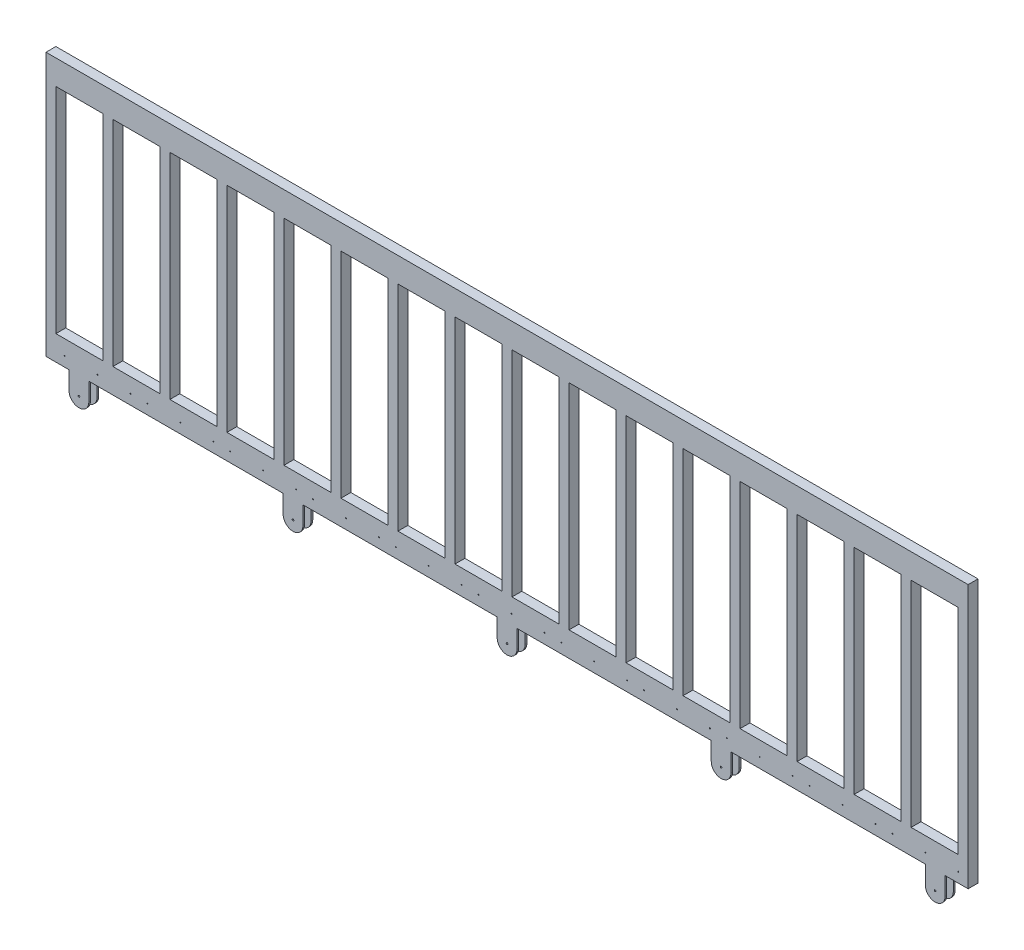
SolidWorks part; units mm, degrees
ref_plane "Plan de face" through (0, 0, 0) normal (0, 0, 1) x (1, 0, 0)
ref_plane "Plan de dessus" through (0, 0, 0) normal (0, 1, 0) x (1, 0, 0)
ref_plane "Plan de droite" through (0, 0, 0) normal (1, 0, 0) x (0, 0, -1)
sketch "Esquisse1" plane through (0, 0, 0) normal (0, 0, 1) x (1, 0, 0)
  line L1 (0, 0) -> (5600, 0)
  line L2 (0, 0) -> (0, 1600)
  line L3 (0, 1600) -> (5600, 1600)
  line L4 (5600, 0) -> (5600, 1600)
  dimension "D1" = 5600
  dimension "D2" = 1600
extrude "Boss.-Extru.1" add sketch "Esquisse1" against normal mid plane 60
sketch "Esquisse2" plane through (0, 0, 30) normal (0, 0, 1) x (1, 0, 0)
  line L0 (0, 800) -> (3591.6944, 800) construction
  line L1 (0, 1600) -> (0, 0) construction
  line L2 (5600, 1600) -> (0, 1600) construction
  line L3 (60, 150) -> (346.25, 150)
  line L4 (60, 150) -> (60, 1450)
  line L5 (60, 1450) -> (346.25, 1450)
  line L6 (346.25, 150) -> (346.25, 1450)
  line L7 (60, 150) -> (346.25, 1450) construction
  line L8 (60, 1450) -> (346.25, 150) construction
  line L9 (406.25, 150) -> (692.5, 150)
  line L10 (406.25, 150) -> (406.25, 1450)
  line L11 (406.25, 1450) -> (692.5, 1450)
  line L12 (692.5, 150) -> (692.5, 1450)
  line L13 (406.25, 150) -> (692.5, 1450) construction
  line L14 (406.25, 1450) -> (692.5, 150) construction
  line L15 (752.5, 150) -> (1038.75, 150)
  line L16 (752.5, 150) -> (752.5, 1450)
  line L17 (752.5, 1450) -> (1038.75, 1450)
  line L18 (1038.75, 150) -> (1038.75, 1450)
  line L19 (752.5, 150) -> (1038.75, 1450) construction
  line L20 (752.5, 1450) -> (1038.75, 150) construction
  line L21 (1098.75, 150) -> (1385, 150)
  line L22 (1098.75, 150) -> (1098.75, 1450)
  line L23 (1098.75, 1450) -> (1385, 1450)
  line L24 (1385, 150) -> (1385, 1450)
  line L25 (1098.75, 150) -> (1385, 1450) construction
  line L26 (1098.75, 1450) -> (1385, 150) construction
  line L27 (1445, 150) -> (1731.25, 150)
  line L28 (1445, 150) -> (1445, 1450)
  line L29 (1445, 1450) -> (1731.25, 1450)
  line L30 (1731.25, 150) -> (1731.25, 1450)
  line L31 (1445, 150) -> (1731.25, 1450) construction
  line L32 (1445, 1450) -> (1731.25, 150) construction
  line L33 (1791.25, 150) -> (2077.5, 150)
  line L34 (1791.25, 150) -> (1791.25, 1450)
  line L35 (1791.25, 1450) -> (2077.5, 1450)
  line L36 (2077.5, 150) -> (2077.5, 1450)
  line L37 (1791.25, 150) -> (2077.5, 1450) construction
  line L38 (1791.25, 1450) -> (2077.5, 150) construction
  line L39 (2137.5, 150) -> (2423.75, 150)
  line L40 (2137.5, 150) -> (2137.5, 1450)
  line L41 (2137.5, 1450) -> (2423.75, 1450)
  line L42 (2423.75, 150) -> (2423.75, 1450)
  line L43 (2137.5, 150) -> (2423.75, 1450) construction
  line L44 (2137.5, 1450) -> (2423.75, 150) construction
  line L45 (2483.75, 150) -> (2770, 150)
  line L46 (2483.75, 150) -> (2483.75, 1450)
  line L47 (2483.75, 1450) -> (2770, 1450)
  line L48 (2770, 150) -> (2770, 1450)
  line L49 (2483.75, 150) -> (2770, 1450) construction
  line L50 (2483.75, 1450) -> (2770, 150) construction
  line L51 (2830, 150) -> (3116.25, 150)
  line L52 (2830, 150) -> (2830, 1450)
  line L53 (2830, 1450) -> (3116.25, 1450)
  line L54 (3116.25, 150) -> (3116.25, 1450)
  line L55 (2830, 150) -> (3116.25, 1450) construction
  line L56 (2830, 1450) -> (3116.25, 150) construction
  line L57 (3176.25, 150) -> (3462.5, 150)
  line L58 (3176.25, 150) -> (3176.25, 1450)
  line L59 (3176.25, 1450) -> (3462.5, 1450)
  line L60 (3462.5, 150) -> (3462.5, 1450)
  line L61 (3176.25, 150) -> (3462.5, 1450) construction
  line L62 (3176.25, 1450) -> (3462.5, 150) construction
  line L63 (3522.5, 150) -> (3808.75, 150)
  line L64 (3522.5, 150) -> (3522.5, 1450)
  line L65 (3522.5, 1450) -> (3808.75, 1450)
  line L66 (3808.75, 150) -> (3808.75, 1450)
  line L67 (3522.5, 150) -> (3808.75, 1450) construction
  line L68 (3522.5, 1450) -> (3808.75, 150) construction
  line L69 (3868.75, 150) -> (4155, 150)
  line L70 (3868.75, 150) -> (3868.75, 1450)
  line L71 (3868.75, 1450) -> (4155, 1450)
  line L72 (4155, 150) -> (4155, 1450)
  line L73 (3868.75, 150) -> (4155, 1450) construction
  line L74 (3868.75, 1450) -> (4155, 150) construction
  line L75 (4215, 150) -> (4501.25, 150)
  line L76 (4215, 150) -> (4215, 1450)
  line L77 (4215, 1450) -> (4501.25, 1450)
  line L78 (4501.25, 150) -> (4501.25, 1450)
  line L79 (4215, 150) -> (4501.25, 1450) construction
  line L80 (4215, 1450) -> (4501.25, 150) construction
  line L81 (4561.25, 150) -> (4847.5, 150)
  line L82 (4561.25, 150) -> (4561.25, 1450)
  line L83 (4561.25, 1450) -> (4847.5, 1450)
  line L84 (4847.5, 150) -> (4847.5, 1450)
  line L85 (4561.25, 150) -> (4847.5, 1450) construction
  line L86 (4561.25, 1450) -> (4847.5, 150) construction
  line L87 (4907.5, 150) -> (5193.75, 150)
  line L88 (4907.5, 150) -> (4907.5, 1450)
  line L89 (4907.5, 1450) -> (5193.75, 1450)
  line L90 (5193.75, 150) -> (5193.75, 1450)
  line L91 (4907.5, 150) -> (5193.75, 1450) construction
  line L92 (4907.5, 1450) -> (5193.75, 150) construction
  line L93 (5253.75, 150) -> (5540, 150)
  line L94 (5253.75, 150) -> (5253.75, 1450)
  line L95 (5253.75, 1450) -> (5540, 1450)
  line L96 (5540, 150) -> (5540, 1450)
  line L97 (5253.75, 150) -> (5540, 1450) construction
  line L98 (5253.75, 1450) -> (5540, 150) construction
  point P4 (203.125, 800)
  point P12 (549.375, 800)
  point P17 (895.625, 800)
  point P22 (1241.875, 800)
  point P27 (1588.125, 800)
  point P32 (1934.375, 800)
  point P37 (2280.625, 800)
  point P42 (2626.875, 800)
  point P47 (5396.875, 800)
  point P48 (2973.125, 800)
  point P53 (3319.375, 800)
  point P58 (3665.625, 800)
  point P63 (4011.875, 800)
  point P68 (4358.125, 800)
  point P73 (4704.375, 800)
  point P78 (5050.625, 800)
  dimension "D1" = 150
  dimension "D2" = 60
  dimension "D3" = 286.25
  dimension "D4" = 16
extrude "Enlèv. mat.-Extru.1" cut sketch "Esquisse2" against normal through all
shell "Coque3" thickness 3
sketch "Esquisse3" plane through (0, 0, 30) normal (0, 0, 1) x (1, 0, 0)
  line L0 (2800, 0) -> (2800, 1880.7064) construction
  line L1 (0, 0) -> (5600, 0) construction
  line L2 (2740, 0) -> (2860, 0)
  line L3 (2740, 0) -> (2740, -110)
  line L4 (2860, 0) -> (2860, -110)
  line L5 (4040, 0) -> (4160, 0)
  line L6 (4040, 0) -> (4040, -110)
  line L7 (4160, 0) -> (4160, -110)
  line L8 (2740, 0) -> (2860, 0)
  line L9 (2740, 0) -> (2740, -110)
  line L10 (2860, 0) -> (2860, -110)
  line L11 (1440, 0) -> (1560, 0)
  line L12 (1440, 0) -> (1440, -110)
  line L13 (1560, 0) -> (1560, -110)
  line L14 (140, 0) -> (260, 0)
  line L15 (140, 0) -> (140, -110)
  line L16 (260, 0) -> (260, -110)
  line L17 (1440, 0) -> (1560, 0)
  line L18 (1440, 0) -> (1440, -110)
  line L19 (1560, 0) -> (1560, -110)
  line L20 (5340, 0) -> (5460, 0)
  line L21 (5340, 0) -> (5340, -110)
  line L22 (5460, 0) -> (5460, -110)
  line L23 (4040, 0) -> (4160, 0)
  line L24 (4040, 0) -> (4040, -110)
  line L25 (4160, 0) -> (4160, -110)
  line L26 (2740, 0) -> (2860, 0)
  line L27 (2740, 0) -> (2740, -110)
  line L28 (2860, 0) -> (2860, -110)
  arc A0 (2740, -110) -> (2860, -110) centre (2800, -110) ccw
  circle A1 centre (2800, -110) radius 5
  arc A2 (4040, -110) -> (4160, -110) centre (4100, -110) ccw
  circle A3 centre (4100, -110) radius 5
  arc A4 (2740, -110) -> (2860, -110) centre (2800, -110) ccw
  circle A5 centre (2800, -110) radius 5
  arc A6 (1440, -110) -> (1560, -110) centre (1500, -110) ccw
  circle A7 centre (1500, -110) radius 5
  arc A8 (140, -110) -> (260, -110) centre (200, -110) ccw
  circle A9 centre (200, -110) radius 5
  arc A10 (1440, -110) -> (1560, -110) centre (1500, -110) ccw
  circle A11 centre (1500, -110) radius 5
  arc A12 (5340, -110) -> (5460, -110) centre (5400, -110) ccw
  circle A13 centre (5400, -110) radius 5
  arc A14 (4040, -110) -> (4160, -110) centre (4100, -110) ccw
  circle A15 centre (4100, -110) radius 5
  arc A16 (2740, -110) -> (2860, -110) centre (2800, -110) ccw
  circle A17 centre (2800, -110) radius 5
  dimension "D2" = 10
  dimension "D1" = 120
  dimension "D5" = 110
  dimension "D3" = 3
  dimension "D4" = 3
extrude "Boss.-Extru.2" add sketch "Esquisse3" against normal blind 10
mirror "Symétrie1" about plane through (0, 0, 0) normal (0, 0, 1) of "Boss.-Extru.2"
sketch "Esquisse4" plane through (0, 0, 30) normal (0, 0, 1) x (1, 0, 0)
  line L0 (3725.6904, 60) -> (2697.2513, 60) construction
  line L1 (5600, 0) -> (5600, 1600) construction
  line L2 (4160, 0) -> (5340, 0) construction
  circle A0 centre (5540, 60) radius 3
  circle A1 centre (5340, 60) radius 3
  circle A2 centre (5140, 60) radius 3
  dimension "D1" = 6
  dimension "D2" = 60
  dimension "D3" = 60
  dimension "D4" = 3
extrude "Enlèv. mat.-Extru.2" cut sketch "Esquisse4" against normal through all
pattern_linear "Répétition linéaire1" count 11 spacing 502.65 along (-1, 0, 0) of "Enlèv. mat.-Extru.2"
